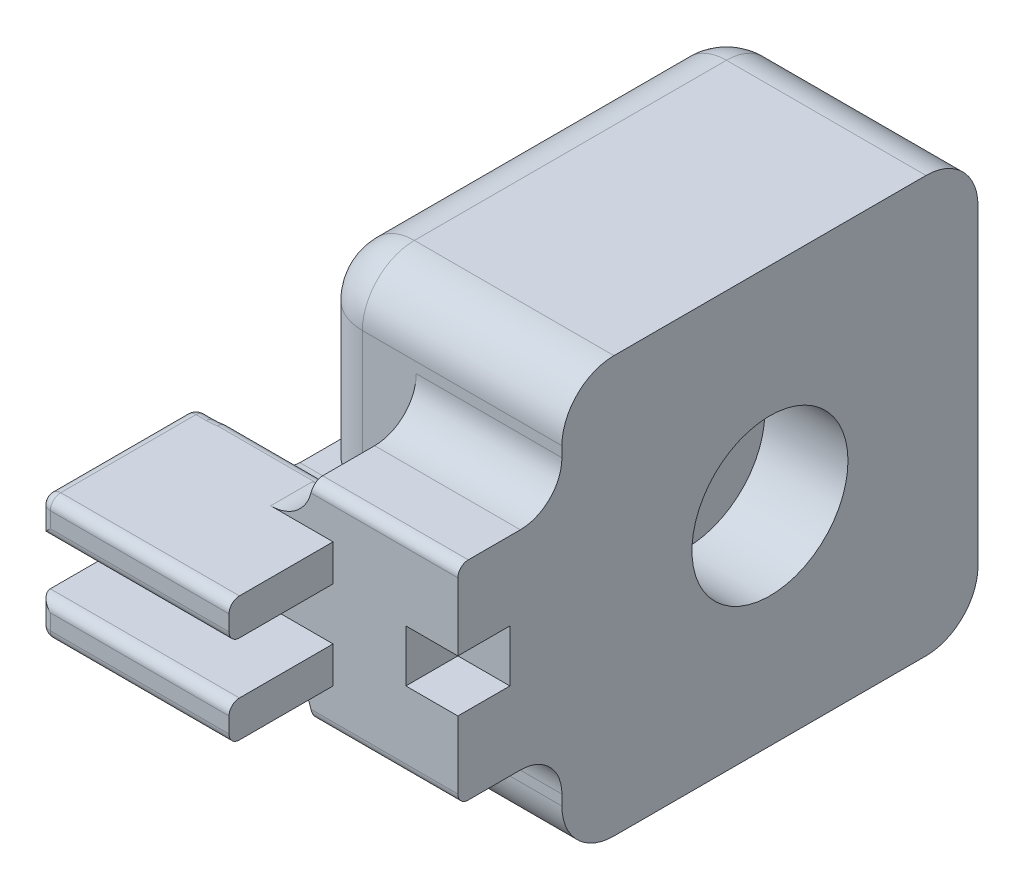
SolidWorks part; units mm, degrees
other "Markup1"
sketch "Sketch18" plane through (-127, 2.54, 10.16) normal (0, 1, 0) x (1, 0, 0)
sketch "Sketch20" plane through (-127, 2.54, 10.16) normal (0, 1, 0) x (1, 0, 0)
sketch "Sketch21" plane through (-127, 2.54, 10.16) normal (0, 1, 0) x (1, 0, 0)
sketch "Sketch22" plane through (-127, 2.54, 10.16) normal (0, 1, 0) x (1, 0, 0)
sketch "Sketch23" plane through (-127, 2.54, 10.16) normal (0, 1, 0) x (1, 0, 0)
sketch "Sketch24" plane through (-127, 2.54, 10.16) normal (0, 1, 0) x (1, 0, 0)
sketch "Sketch25" plane through (-127, 2.54, 10.16) normal (0, 1, 0) x (1, 0, 0)
sketch "Sketch27" plane through (-127, 2.54, 0) normal (0, 1, 0) x (1, 0, 0)
sketch "Sketch29" plane through (-127, 2.54, 0) normal (0, 1, 0) x (1, 0, 0)
sketch "Sketch30" plane through (-127, 2.54, 0) normal (0, 1, 0) x (1, 0, 0)
sketch "Sketch44" plane through (0, 25.4, -63.5) normal (0, 1, 0) x (1, 0, 0)
sketch "Sketch48" plane through (88.6689, 25.4, -63.5) normal (0, 1, 0) x (1, 0, 0)
ref_plane "Front Plane" through (0, 0, 0) normal (0, 0, 1) x (1, 0, 0)
ref_plane "Top Plane" through (0, 0, 0) normal (0, 1, 0) x (1, 0, 0)
ref_plane "Right Plane" through (0, 0, 0) normal (1, 0, 0) x (0, 0, -1)
sketch "Sketch1" plane through (0, 0, 0) normal (0, 0, 1) x (1, 0, 0)
  line L6 (127, 2.54) -> (-127, 2.54)
  line L24 (127, 2.54) -> (127, -2.54)
  line L25 (127, -2.54) -> (-127, -2.54)
  line L26 (-127, 2.54) -> (-127, -2.54)
  line L27 (127, 2.54) -> (-127, -2.54) construction
  line L28 (127, -2.54) -> (-127, 2.54) construction
  point P0 (0, 0)
  point P1 (0, 0)
  dimension "D1" = 5.08
  dimension "D2" = 254
extrude "Boss-Extrude1" add sketch "Sketch1" along normal blind 203.2
sketch "Sketch2" plane through (0, 2.54, 0) normal (0, 1, 0) x (1, 0, 0)
  line L0 (127, -203.2) -> (-127, -203.2) construction
  line L1 (-127, 0) -> (-101.6, 0)
  line L2 (-127, 0) -> (-127, -203.2)
  line L3 (-127, -203.2) -> (-101.6, -203.2)
  line L4 (-101.6, 0) -> (-101.6, -203.2)
  line L6 (127, 0) -> (101.6, 0)
  line L7 (127, 0) -> (127, -203.2)
  line L8 (127, -203.2) -> (101.6, -203.2)
  line L9 (101.6, 0) -> (101.6, -203.2)
  dimension "D1" = 25.4
sketch "Sketch3" plane through (0, 2.54, 0) normal (0, 1, 0) x (1, 0, 0)
  line L1 (-127, -22.86) -> (-101.6, -22.86) construction
  line L2 (-127, 0) -> (-127, -203.2) construction
  line L3 (-101.6, 0) -> (-101.6, -203.2) construction
  line L4 (-114.3, -22.86) -> (-114.3, -180.34) construction
  line L5 (0, 0) -> (0, -203.2) construction
  line L6 (127, 0) -> (-127, 0) construction
  line L7 (127, -203.2) -> (-127, -203.2) construction
  line L8 (-127, 0) -> (-101.6, 0) construction
  line L9 (101.6, -21.6084) -> (127, -21.6084) construction
  line L10 (101.6, 0) -> (101.6, -203.2) construction
  line L11 (127, 0) -> (127, -203.2) construction
  circle A0 centre (-114.3, -22.86) radius 2.1
  circle A1 centre (-114.3, -180.34) radius 2.1
  circle A2 centre (114.3, -22.86) radius 2.1
  circle A3 centre (114.3, -180.34) radius 2.1
  point P14 (-114.3, -22.86)
  point P21 (-114.3, -101.6)
  point P22 (0, -101.6)
  point P26 (114.3, -21.6084)
  dimension "D1" = 4.2
  dimension "D2" = 22.86
extrude "Cut-Extrude1" [suppressed] cut sketch "Sketch3" against normal through all
sketch "Sketch5" plane through (0, 2.54, 0) normal (0, 1, 0) x (1, 0, 0)
  circle A2 centre (97.63, -133.2) radius 1.8288
  circle A3 centre (97.63, -133.2) radius 1.8288
  circle A4 centre (97.63, -145.9) radius 1.8288
  circle A5 centre (97.63, -145.9) radius 1.8288
  circle A6 centre (-19.21, -133.2) radius 1.8288
  circle A7 centre (-19.21, -133.2) radius 1.8288
  circle A8 centre (-19.21, -145.9) radius 1.8288
  circle A9 centre (-19.21, -145.9) radius 1.8288
  circle A13 centre (-97.696, -133.2) radius 1.8288
  circle A14 centre (-97.696, -145.9) radius 1.8288
  circle A15 centre (19.144, -133.2) radius 1.8288
  circle A16 centre (19.144, -145.9) radius 1.8288
  dimension "D5" = 78.486
  dimension "D6" = 78.486
  dimension "D1" = 0
  dimension "D2" = 0
  dimension "D3" = 0
  dimension "D4" = 0
extrude "Cut-Extrude2" cut sketch "Sketch5" against normal blind 152.4
sketch "Sketch7" [suppressed] plane through (0, -2.54, 0) normal (0, -1, 0) x (1, 0, 0)
  line L1 (-127, 203.2) -> (-101.6, 203.2)
  line L2 (-127, 203.2) -> (-127, 0)
  line L3 (-127, 0) -> (-101.6, 0)
  line L4 (-101.6, 203.2) -> (-101.6, 0)
  line L5 (127, 203.2) -> (101.6, 203.2)
  line L6 (127, 203.2) -> (127, 0)
  line L7 (127, 0) -> (101.6, 0)
  line L8 (101.6, 203.2) -> (101.6, 0)
  circle A0 centre (-114.3, 180.34) radius 6.35
  circle A1 centre (-114.3, 22.86) radius 6.35
  circle A2 centre (114.3, 22.86) radius 6.35
  circle A3 centre (114.3, 180.34) radius 6.35
  dimension "D1" = 12.7
extrude "Boss-Extrude2" [suppressed] add sketch "Sketch7" along normal blind 7.62
sketch "Sketch8" [suppressed] plane through (0, 2.54, 0) normal (0, 1, 0) x (1, 0, 0)
  circle A0 centre (-89.6874, -180.34) radius 3.175
  circle A1 centre (-89.6874, -154.94) radius 3.175
  point P3 (-114.3, -180.34)
  dimension "D1" = 6.35
  dimension "D2" = 24.6126
  dimension "D3" = 25.4
sketch "Sketch9" plane through (0, 2.54, 0) normal (0, 1, 0) x (1, 0, 0)
  line L0 (127, 0) -> (-127, 0) construction
  line L1 (-91.63, 0) -> (-83.63, 0)
  line L2 (-91.63, 0) -> (-91.63, -12.7)
  line L3 (-91.63, -12.7) -> (-83.63, -12.7)
  line L4 (-83.63, 0) -> (-83.63, -12.7)
  line L5 (-87.63, 0) -> (-87.63, -55.7623) construction
  line L6 (-127, -203.2) -> (-127, 0) construction
  line L7 (-61.405, -25.4) -> (-61.405, -12.7) construction
  circle A0 centre (-61.405, -12.7) radius 3.175
  circle A1 centre (-61.405, -25.4) radius 3.175
  dimension "D1" = 6.35
  dimension "D2" = 6.35
  dimension "D3" = 39.37
  dimension "D4" = 12.7
  dimension "D5" = 12.7
  dimension "D6" = 8
  dimension "D7" = 22.225
  dimension "D8" = 4
  dimension "D9" = 12.7
sketch "Sketch12" plane through (0, 2.54, 0) normal (0, 1, 0) x (1, 0, 0)
  line L0 (-91.7385, -29.21) -> (-40.9385, -29.21) construction
  line L1 (-127, -203.2) -> (-127, 0) construction
  line L2 (-66.3384, -41.91) -> (-66.3384, -16.51) construction
  line L4 (127, 0) -> (-127, 0) construction
  circle A0 centre (-91.7385, -29.21) radius 3.175
  circle A1 centre (-40.9385, -29.21) radius 3.175
  circle A2 centre (-66.3384, -16.51) radius 3.175
  circle A3 centre (-66.3384, -41.91) radius 3.175
  point P8 (-66.3385, -29.21)
  point P11 (-66.3385, -29.21)
  dimension "D1" = 6.35
  dimension "D2" = 50.8
  dimension "D3" = 29.21
  dimension "D4" = 25.4
  dimension "D5" = 60.6615
extrude "Cut-Extrude7" cut sketch "Sketch12" against normal through all
sketch "Sketch14" plane through (0, 2.54, 0) normal (0, 1, 0) x (1, 0, 0)
  line L0 (127, 0) -> (-127, 0) construction
  line L1 (-127, -203.2) -> (-127, 0) construction
  circle A0 centre (-32.8328, -16.51) radius 3.175
  circle A1 centre (-32.8328, -41.91) radius 3.175
  dimension "D1" = 6.35
  dimension "D4" = 94.1672
  dimension "D2" = 25.4
  dimension "D3" = 16.51
extrude "Cut-Extrude8" cut sketch "Sketch14" against normal up to next
mirror "Mirror1" about plane through (0, 0, 0) normal (1, 0, 0) of "Cut-Extrude8", "Cut-Extrude7"
sketch "Sketch15" plane through (0, 2.54, 0) normal (0, 1, 0) x (1, 0, 0)
  line L0 (127, -203.2) -> (127, 0) construction
  line L1 (-127, 0) -> (127, 0)
  line L2 (-127, 0) -> (-127, -10.16)
  line L3 (-127, -10.16) -> (127, -10.16)
  line L4 (127, 0) -> (127, -10.16)
  dimension "D1" = 10.16
extrude "Cut-Extrude9" [suppressed] cut sketch "Sketch15" against normal up to next
sketch "Sketch16" plane through (0, 2.54, 0) normal (0, 1, 0) x (1, 0, 0)
  line L0 (127, -203.2) -> (127, 0) construction
  line L1 (127, -203.2) -> (-127, -203.2) construction
  circle A0 centre (84.0486, -196.85) radius 3.175
  circle A1 centre (84.0486, -171.45) radius 3.175
  dimension "D2" = 6.35
  dimension "D1" = 42.9514
  dimension "D3" = 25.4
  dimension "D4" = 6.35
extrude "Cut-Extrude10" cut sketch "Sketch16" against normal through all
mirror "Mirror2" about plane through (0, 0, 0) normal (1, 0, 0) of "Cut-Extrude10"
sketch "Sketch17" plane through (0, 2.54, 0) normal (0, 1, 0) x (1, 0, 0)
  line L0 (-97.696, -133.2) -> (-19.21, -133.2) construction
  line L1 (-58.453, -133.2) -> (-58.453, -151.0054) construction
  point P6 (-19.21, -133.2)
ref_plane "Plane1" through (-58.453, 0, 0) normal (-1, 0, 0) x (0, 0, 1)
sketch "Sketch19" plane through (0, 2.54, 0) normal (0, 1, 0) x (1, 0, 0)
  line L0 (-84.0486, -171.45) -> (-28.3574, -171.45) construction
  line L1 (-84.0486, -196.85) -> (-28.3574, -196.85) construction
  line L2 (-84.0486, -182.2625) -> (-58.453, -182.2625) construction
  line L3 (-58.453, 111.76) -> (-58.453, -111.76) construction
  line L4 (-58.453, -182.2625) -> (-32.8574, -182.2625) construction
  circle A0 centre (-28.3574, -171.45) radius 3.175
  circle A1 centre (-28.3574, -196.85) radius 3.175
  circle A2 centre (-84.0486, -171.45) radius 3.175 construction
  dimension "D1" = 4.5
extrude "Cut-Extrude11" cut sketch "Sketch19" against normal up to next
mirror "Mirror3" about plane through (0, 0, 0) normal (1, 0, 0) of "Cut-Extrude11"
sketch "Sketch26" plane through (0, 2.54, 0) normal (0, 1, 0) x (1, 0, 0)
  line L1 (-98.2063, -23.913) -> (-35.7027, -23.913)
  line L2 (-98.2063, -23.913) -> (-98.2063, -34.7388)
  line L3 (-98.2063, -34.7388) -> (-35.7027, -34.7388)
  line L4 (-35.7027, -23.913) -> (-35.7027, -34.7388)
  line L5 (31.7031, -23.913) -> (98.7003, -23.913)
  line L6 (31.7031, -23.913) -> (31.7031, -34.7388)
  line L7 (31.7031, -34.7388) -> (98.7003, -34.7388)
  line L8 (98.7003, -23.913) -> (98.7003, -34.7388)
extrude "Boss-Extrude3" add sketch "Sketch26" against normal up to surface (5.08 mm away)
sketch "Sketch28" plane through (0, 2.54, 0) normal (0, 1, 0) x (1, 0, 0)
  line L0 (127, -203.2) -> (-127, -203.2) construction
  line L1 (-68.903, -203.2) -> (-43.503, -203.2)
  line L2 (-68.903, -203.2) -> (-68.903, -190.5)
  line L3 (-68.903, -190.5) -> (-43.503, -190.5)
  line L4 (-43.503, -203.2) -> (-43.503, -190.5)
  line L5 (-84.0486, -171.45) -> (-28.3574, -171.45) construction
  line L6 (43.503, -203.2) -> (68.903, -203.2)
  line L7 (43.503, -203.2) -> (43.503, -190.5)
  line L8 (43.503, -190.5) -> (68.903, -190.5)
  line L9 (68.903, -203.2) -> (68.903, -190.5)
  line L10 (28.3574, -171.45) -> (84.0486, -171.45) construction
  point P18 (-56.203, -190.5)
  point P19 (-56.203, -171.45)
  point P20 (56.203, -190.5)
  point P21 (56.203, -171.45)
  dimension "D1" = 25.4
  dimension "D2" = 12.7
extrude "Cut-Extrude12" cut sketch "Sketch28" against normal up to next
sketch "Sketch31" plane through (0, 2.54, 0) normal (0, 1, 0) x (1, 0, 0)
  line L0 (-127, 0) -> (127, 0) construction
  line L2 (-127, -203.2) -> (0, -203.2)
  line L3 (-127, -203.2) -> (-127, 0)
  line L4 (-127, 0) -> (0, 0)
  line L5 (0, -203.2) -> (0, 0)
extrude "Cut-Extrude14" cut sketch "Sketch31" against normal up to next
sketch "Sketch34" plane through (0, 2.54, 0) normal (0, 1, 0) x (1, 0, 0)
  line L1 (127, 0) -> (114.3, 0)
  line L2 (127, 0) -> (127, 152.4)
  line L3 (127, 152.4) -> (114.3, 152.4)
  line L4 (114.3, 0) -> (114.3, 152.4)
  dimension "D1" = 12.7
  dimension "D2" = 152.4
extrude "Boss-Extrude5" add sketch "Sketch34" against normal up to surface (5.08 mm away)
sketch "Sketch35" plane through (0, -2.54, 0) normal (0, -1, 0) x (1, 0, 0)
  line L0 (93.7489, 203.2) -> (93.7489, -151.0184)
  line L1 (68.903, 203.2) -> (127, 203.2) construction
  line L2 (127, 203.2) -> (127, -152.4) construction
  line L3 (127, -38.1) -> (93.7489, -38.1)
  line L4 (0, 0) -> (114.3, 0) construction
  dimension "D1" = 33.2511
  dimension "D2" = 38.1
sketch "Sketch36" plane through (114.3, 0, 0) normal (-1, 0, 0) x (0, 0, 1)
  line L0 (-38.1, -2.54) -> (-38.1, 2.54) construction
  line L1 (203.2, -2.54) -> (-151.0184, -2.54) construction
  line L2 (-152.4, 2.54) -> (0, 2.54) construction
  line L4 (-12.7, -25.4) -> (-63.5, -25.4)
  line L5 (-12.7, -25.4) -> (-12.7, 25.4)
  line L6 (-12.7, 25.4) -> (-63.5, 25.4)
  line L7 (-63.5, -25.4) -> (-63.5, 25.4)
  line L8 (-12.7, -25.4) -> (-63.5, 25.4) construction
  line L9 (-12.7, 25.4) -> (-63.5, -25.4) construction
  point P8 (-38.1, 0)
  dimension "D1" = 50.8
extrude "Boss-Extrude6" add sketch "Sketch36" against normal up to surface (12.7 mm away)
sketch "Sketch37" plane through (114.3, 0, 0) normal (-1, 0, 0) x (0, 0, 1)
  line L0 (-12.7, 25.4) -> (-63.5, 25.4) construction
  circle A0 centre (-38.1, 0) radius 4
  point P4 (-38.1, 25.4)
  dimension "D1" = 8
extrude "Cut-Extrude15" cut sketch "Sketch37" against normal up to next
sketch "Sketch38" plane through (0, -2.54, 0) normal (0, -1, 0) x (1, 0, 0)
  line L0 (127, -63.5) -> (114.3, -63.5) construction
  line L1 (102.4579, -63.5) -> (162.4454, -63.5)
  line L2 (102.4579, -63.5) -> (102.4579, -165.9179)
  line L3 (102.4579, -165.9179) -> (162.4454, -165.9179)
  line L4 (162.4454, -63.5) -> (162.4454, -165.9179)
extrude "Cut-Extrude16" cut sketch "Sketch38" against normal up to next
sketch "Sketch39" plane through (114.3, 0, 0) normal (-1, 0, 0) x (0, 0, 1)
  line L1 (-12.7, -25.4) -> (-63.5, -25.4)
  line L2 (-12.7, -25.4) -> (-12.7, 25.4)
  line L3 (-12.7, 25.4) -> (-63.5, 25.4)
  line L4 (-63.5, -25.4) -> (-63.5, 25.4)
  line L5 (-12.7, -25.4) -> (-63.5, 25.4) construction
  line L6 (-12.7, 25.4) -> (-63.5, -25.4) construction
  circle A0 centre (-38.1, 0) radius 4 construction
  circle A1 centre (-38.1, 0) radius 4
  point P0 (-38.1, 0)
extrude "Boss-Extrude7" add sketch "Sketch39" along normal up to vertex
sketch "Sketch40" plane through (93.7489, 0, 0) normal (-1, 0, 0) x (0, 0, 1)
  line L1 (-12.7, -25.4) -> (-63.5, -25.4)
  line L2 (-12.7, -25.4) -> (-12.7, 25.4)
  line L3 (-12.7, 25.4) -> (-63.5, 25.4)
  line L4 (-63.5, -25.4) -> (-63.5, 25.4)
  line L5 (-12.7, -25.4) -> (-63.5, 25.4) construction
  line L6 (-12.7, 25.4) -> (-63.5, -25.4) construction
  circle A0 centre (-38.1, 0) radius 8.255
  circle A1 centre (-38.1, 0) radius 4 construction
  dimension "D1" = 16.51
extrude "Cut-Extrude17" cut sketch "Sketch40" against normal blind 2.54
sketch "Sketch41" plane through (0, 0, 0) normal (0, 0, -1) x (-1, 0, 0)
  line L0 (-127, -2.54) -> (-93.7489, -2.54) construction
  line L1 (-114.3, -2.54) -> (-96.2889, -2.54)
  line L2 (-114.3, -2.54) -> (-114.3, 2.54)
  line L3 (-114.3, 2.54) -> (-96.2889, 2.54)
  line L4 (-96.2889, -2.54) -> (-96.2889, 2.54)
  line L5 (-114.3, 2.54) -> (0, 2.54) construction
  line L6 (-96.2889, -25.4) -> (-96.2889, 25.4) construction
  line L7 (-114.3, -2.54) -> (-114.3, 2.54) construction
extrude "Boss-Extrude8" add sketch "Sketch41" along normal up to surface (12.7 mm away)
sketch "Sketch42" plane through (0, 0, -12.7) normal (0, 0, 1) x (1, 0, 0)
  line L6 (79.901, 2.54) -> (79.901, -2.54) construction
  line L7 (127, 2.54) -> (68.903, 2.54) construction
  line L8 (68.903, -2.54) -> (127, -2.54) construction
  line L9 (127, 25.4) -> (127, 2.54) construction
  line L10 (127, 12.7) -> (119.38, 12.7)
  line L11 (127, 12.7) -> (127, 2.54)
  line L12 (127, 2.54) -> (119.38, 2.54)
  line L13 (119.38, 12.7) -> (119.38, 2.54)
  line L15 (127, 2.54) -> (96.2889, 2.54) construction
  dimension "D1" = 10.16
  dimension "D2" = 7.62
extrude "Boss-Extrude9" add sketch "Sketch42" along normal up to surface (215.9 mm away)
ref_plane "Plane2" through (0, 0, 0) normal (0, -1, 0) x (-1, 0, 0)
mirror "Mirror4" about plane through (0, 0, 0) normal (0, -1, 0) of "Boss-Extrude9"
fillet "Fillet2" radius 12.7 1 edges at (96.2889, 0, 0)
fillet "Fillet3" radius 10.16 4 edges at (119.38, 2.54, 95.25) (119.38, -2.54, 95.25) (119.38, 7.62, -12.7) (119.38, -7.62, -12.7)
fillet "Fillet4" radius 6.35 12 edges at (96.2889, -25.4, -38.1) (96.2889, 0, -63.5) (96.2889, 25.4, -38.1) (96.2889, 13.97, -12.7) (96.2889, -13.97, -12.7) (96.2889, 0, -29.845) (0, 0, 203.2) (0, 0, 0) (111.6444, 25.4, -12.7) (111.6444, 25.4, -63.5) (111.6444, -25.4, -63.5) (111.6444, -25.4, -12.7)
fillet "Fillet5" radius 5.08 2 edges at (68.903, 0, 190.5) (43.503, 0, 190.5)
sketch "Sketch43" plane through (127, 0, 0) normal (1, 0, 0) x (0, 0, -1)
  circle A0 centre (38.1, 0) radius 9.525
  circle A1 centre (38.1, 0) radius 4 construction
  dimension "D1" = 19.05
extrude "Cut-Extrude18" cut sketch "Sketch43" against normal blind 10.16
sketch "Sketch45" plane through (0, 2.54, 0) normal (0, 1, 0) x (1, 0, 0)
  line L0 (83.5889, 0) -> (6.35, 0) construction
  line L1 (-46.2514, 0) -> (167.314, 0)
  line L2 (-46.2514, 0) -> (-46.2514, -229.9)
  line L3 (-46.2514, -229.9) -> (167.314, -229.9)
  line L4 (167.314, 0) -> (167.314, -229.9)
extrude "Cut-Extrude19" cut sketch "Sketch45" against normal through all and the other way through all
sketch "Sketch46" plane through (0, 0, 0) normal (0, 0, 1) x (1, 0, 0)
  line L0 (83.5889, 2.54) -> (83.5889, -2.54) construction
  line L1 (120.65, -3.175) -> (127, -3.175)
  line L2 (120.65, -3.175) -> (120.65, 3.175)
  line L3 (120.65, 3.175) -> (127, 3.175)
  line L4 (127, -3.175) -> (127, 3.175)
  line L5 (120.65, -3.175) -> (127, 3.175) construction
  line L6 (120.65, 3.175) -> (127, -3.175) construction
  line L7 (127, 12.7) -> (127, -12.7) construction
  point P0 (123.825, 0)
  point P8 (83.5889, 0)
  dimension "D1" = 6.35
extrude "Cut-Extrude20" cut sketch "Sketch46" against normal blind 6.35
sketch "Sketch47" plane through (0, -2.54, 0) normal (0, -1, 0) x (1, 0, 0)
  line L0 (96.2889, -19.05) -> (96.2889, -12.7) construction
  line L1 (79.4149, 6.5585) -> (88.6689, 6.5585)
  line L2 (79.4149, 6.5585) -> (79.4149, -8.2176)
  line L3 (79.4149, -8.2176) -> (88.6689, -8.2176)
  line L4 (88.6689, 6.5585) -> (88.6689, -8.2176)
  dimension "D1" = 7.62
extrude "Cut-Extrude21" cut sketch "Sketch47" against normal through all
sketch "Sketch49" plane through (0, -2.54, 0) normal (0, -1, 0) x (1, 0, 0)
  line L0 (127, 0) -> (127, -12.7) construction
  line L1 (88.6689, -6.35) -> (111.76, -6.35)
  line L2 (88.6689, -6.35) -> (88.6689, 12.7)
  line L3 (88.6689, 12.7) -> (111.76, 12.7)
  line L4 (111.76, -6.35) -> (111.76, 12.7)
  line L5 (109.22, 0) -> (88.6689, 0) construction
  line L6 (88.6689, -1.0603) -> (88.6689, 0) construction
  dimension "D1" = 15.24
  dimension "D2" = 6.35
  dimension "D3" = 12.7
extrude "Boss-Extrude10" add sketch "Sketch49" along normal blind 5.08
mirror "Mirror5" about plane through (0, 0, 0) normal (0, 1, 0) of "Boss-Extrude10"
sketch "Sketch50" plane through (0, -7.62, 0) normal (0, -1, 0) x (1, 0, 0)
  line L0 (88.6689, 12.7) -> (88.6689, -6.35) construction
  line L1 (88.6689, -1.0603) -> (104.2797, -1.0603)
  line L2 (88.6689, -1.0603) -> (88.6689, -6.35)
  line L3 (88.6689, -6.35) -> (104.2797, -6.35)
  line L4 (104.2797, -1.0603) -> (104.2797, -6.35)
  line L5 (88.6689, -6.35) -> (111.76, -6.35) construction
  point P8 (0, 0)
extrude "Boss-Extrude11" add sketch "Sketch50" against normal up to surface (15.24 mm away)
sketch "Sketch32" plane through (0, 2.54, 0) normal (0, 1, 0) x (1, 0, 0)
  line L1 (0, 0) -> (6.35, 0)
  line L2 (0, 0) -> (0, -25.4)
  line L3 (0, -25.4) -> (6.35, -25.4)
  line L4 (6.35, 0) -> (6.35, -25.4)
  dimension "D1" = 25.4
  dimension "D2" = 6.35
sketch "Sketch51" plane through (0, 0, 12.7) normal (0, 0, 1) x (1, 0, 0)
  line L0 (-6.985, 0) -> (6.985, 0) construction
  line L1 (111.76, -3.175) -> (88.6689, -3.175)
  line L2 (111.76, -3.175) -> (111.76, 3.175)
  line L3 (111.76, 3.175) -> (88.6689, 3.175)
  line L4 (88.6689, -3.175) -> (88.6689, 3.175)
  line L5 (111.76, -3.175) -> (88.6689, 3.175) construction
  line L6 (111.76, 3.175) -> (88.6689, -3.175) construction
  line L7 (88.6689, 7.62) -> (88.6689, 2.54) construction
  line L8 (111.76, 7.62) -> (111.76, 2.54) construction
  line L9 (111.76, 2.54) -> (88.6689, 2.54) construction
  point P0 (100.2144, 0)
  dimension "D1" = 0.635
extrude "Cut-Extrude22" cut sketch "Sketch51" against normal up to surface (12.7 mm away)
sketch "Sketch52" plane through (0, 0, 0) normal (0, 0, 1) x (1, 0, 0)
  line L0 (127, 12.7) -> (109.22, 12.7) construction
  line L1 (119.38, 12.7) -> (109.22, 12.7)
  line L2 (119.38, 12.7) -> (119.38, -12.7)
  line L3 (119.38, -12.7) -> (109.22, -12.7)
  line L4 (109.22, 12.7) -> (109.22, -12.7)
  line L5 (127, -12.7) -> (109.22, -12.7) construction
  line L6 (109.22, -12.7) -> (109.22, -2.54) construction
  point P8 (0, 0)
extrude "Boss-Extrude12" add sketch "Sketch52" against normal up to surface (12.7 mm away)
sketch "Sketch53" plane through (0, -2.54, 0) normal (0, -1, 0) x (1, 0, 0)
  line L0 (96.2889, -19.05) -> (96.2889, -12.7) construction
  line L1 (96.2889, -14.5221) -> (90.6416, -14.5221)
  line L2 (96.2889, -14.5221) -> (96.2889, -6.35)
  line L3 (96.2889, -6.35) -> (90.6416, -6.35)
  line L4 (90.6416, -14.5221) -> (90.6416, -6.35)
  line L5 (88.6689, -6.35) -> (109.22, -6.35) construction
extrude "Cut-Extrude23" cut sketch "Sketch53" against normal through all
fillet "Fillet6" radius 5.08 7 edges at (96.2889, 0, -6.35) (109.22, -5.08, -6.35) (109.22, 5.08, -6.35) (102.7544, 2.54, -6.35) (102.7544, -2.54, -6.35) (109.22, 7.62, -3.175) (109.22, -7.62, -3.175)
fillet "Fillet7" radius 5.08 2 edges at (118.11, 12.7, -12.7) (118.11, -12.7, -12.7)
fillet "Fillet10" radius 1.27 17 edges at (100.2144, -7.62, 12.7) (100.2144, 7.62, 12.7) (100.2144, 3.175, 12.7) (100.2144, -3.175, 12.7) (88.6689, 5.3975, 12.7) (88.6689, -5.3975, 12.7) (88.6689, -7.62, 3.175) (88.6689, 7.62, 3.175) (88.6689, 0, -6.35) (118.11, 12.7, 0) (118.11, -12.7, 0) (107.7321, 9.1079, -7.8379) (97.6744, 7.62, -6.35) (107.7321, -9.1079, -7.8379) (97.6744, -7.62, -6.35) (89.9389, 7.62, -6.35) (89.9389, -7.62, -6.35)
